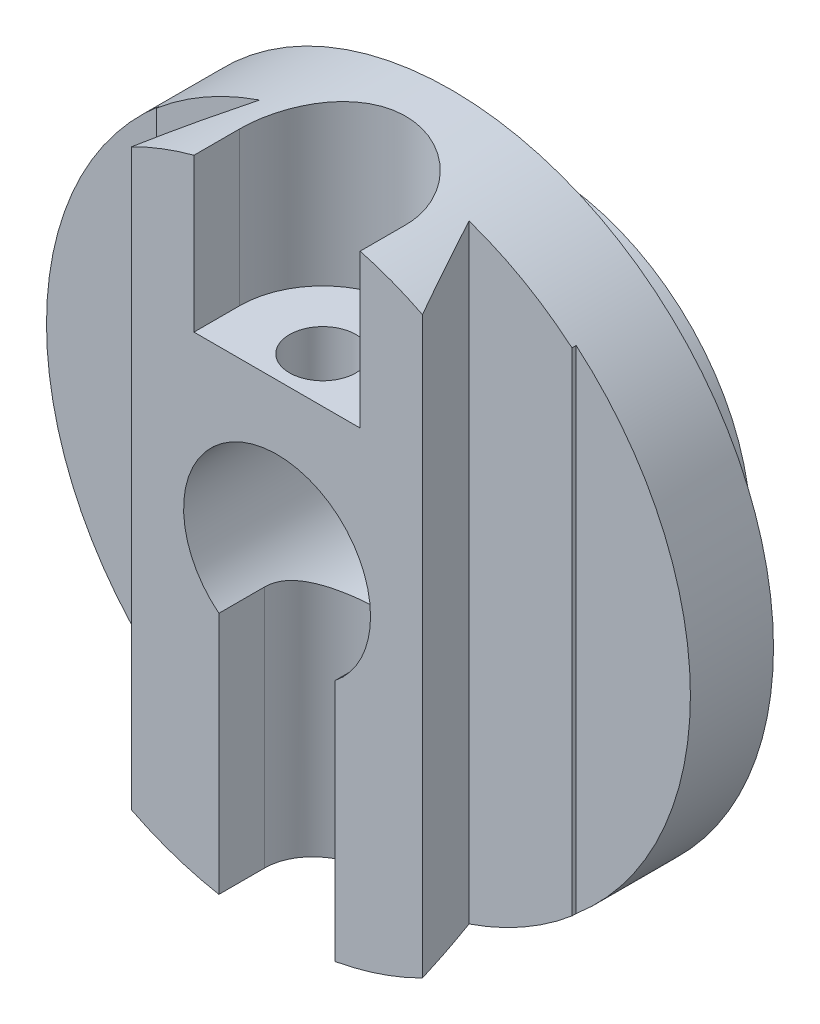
SolidWorks part; units mm, degrees
ref_plane "Front Plane" through (0, 0, 0) normal (0, 0, 1) x (1, 0, 0)
ref_plane "Top Plane" through (0, 0, 0) normal (0, 1, 0) x (1, 0, 0)
ref_plane "Right Plane" through (0, 0, 0) normal (1, 0, 0) x (0, 0, -1)
sketch "Sketch1" plane through (0, 0, 0) normal (0, 0, 1) x (1, 0, 0)
  circle A0 centre (0, 0) radius 77.5
  dimension "D1" = 155
extrude "Boss-Extrude1" add sketch "Sketch1" along normal blind 64
sketch "Sketch2" plane through (0, 0, 0) normal (0, 1, 0) x (1, 0, 0)
  line L0 (77.5, 0) -> (-77.5, 0) construction
  line L1 (50, 0) -> (-50, 0)
  line L2 (50, 0) -> (50, -22)
  line L3 (-77.5, -22) -> (-77.5, 0)
  line L4 (-50, 0) -> (-50, -22)
  line L5 (0, 0) -> (0, -91.0619) construction
  line L6 (-35, -64) -> (-25.2075, -43)
  line L7 (-77.5, -64) -> (77.5, -64) construction
  line L8 (-25.2075, -43) -> (-50, -43)
  line L9 (-50, -43) -> (-50, -42)
  line L10 (-50, -42) -> (-77.5, -42)
  line L11 (-77.5, 0) -> (-77.5, -64) construction
  line L12 (-77.5, -42) -> (-77.5, -22)
  line L13 (-77.5, -22) -> (-50, -22)
  line L14 (-35, -64) -> (35, -64)
  line L15 (77.5, -22) -> (50, -22)
  line L16 (77.5, -42) -> (77.5, -22)
  line L17 (50, -42) -> (77.5, -42)
  line L18 (50, -43) -> (50, -42)
  line L19 (25.2075, -43) -> (50, -43)
  line L20 (35, -64) -> (25.2075, -43)
  line L21 (-77.5, 0) -> (-50, 0)
  line L22 (-77.5, -42) -> (-77.5, -64)
  line L23 (-77.5, -64) -> (-35, -64)
  line L24 (77.5, -64) -> (35, -64)
  line L25 (77.5, -42) -> (77.5, -64)
  line L26 (77.5, 0) -> (50, 0)
  line L27 (77.5, -22) -> (77.5, 0)
  point P22 (0, -64)
  dimension "D1" = 21
  dimension "D2" = 65
  dimension "D3" = 1
  dimension "D4" = 42
  dimension "D5" = 100
  dimension "D6" = 35
  dimension "D7" = 50
extrude "Cut-Extrude1" cut sketch "Sketch2" against normal mid plane 200 contours L21 L3 L13 L4 | L22 L23 L6 L8 L9 L10 | L25 L17 L18 L19 L20 L24 | L15 L27 L26 L2
sketch "Sketch3" plane through (0, 0, 0) normal (0, 1, 0) x (1, 0, 0)
  line L1 (-50, 0) -> (50, 0)
  line L2 (-50, 0) -> (-50, -22)
  line L3 (-50, -22) -> (50, -22)
  line L4 (50, 0) -> (50, -22)
extrude "Cut-Extrude2" cut sketch "Sketch3" against normal mid plane 200
sketch "Sketch4" plane through (0, 0, 22) normal (0, 0, -1) x (-1, 0, 0)
  circle A0 centre (0, 0) radius 50
  dimension "D1" = 100
extrude "Boss-Extrude2" add sketch "Sketch4" along normal blind 22
hole_wizard "Hole1" positions "Sketch5" profile "Sketch6" legacy
sketch "Sketch5" plane through (0, 0, 64) normal (0, 0, 1) x (1, 0, 0)
  point P0 (0, 0)
sketch "Sketch6" plane through (0, 0, 64) normal (1, 0, 0) x (0, -1, 0)
  line L0 (0, 0) -> (0, 64)
  line L1 (0, 64) -> (11, 64)
  line L2 (11, 64) -> (11, 42)
  line L3 (11, 42) -> (22.5, 42)
  line L4 (22.5, 42) -> (22.5, 0)
  line L5 (22.5, 0) -> (0, 0)
  line L6 (0, 110) -> (0, -10) construction
  dimension "Diameter" = 22
  dimension "Depth" = 64
  dimension "C-Bore Diameter" = 45
  dimension "C-Bore Depth" = 42
ref_plane "Plane1" through (0, 77.5, 0) normal (0, 1, 0) x (1, 0, 0)
sketch "Sketch8" plane through (0, 77.5, 0) normal (0, 1, 0) x (1, 0, 0)
  line L0 (-35, -64) -> (35, -64) construction
  line L1 (-20, -64) -> (20, -64)
  line L2 (-20, -64) -> (-20, -53)
  line L4 (20, -64) -> (20, -53)
  arc A0 (-20, -53) -> (20, -53) centre (0, -53) cw
  point P7 (0, 0)
  dimension "D1" = 20
  dimension "D2" = 11
extrude "Cut-Extrude3" cut sketch "Sketch8" against normal blind 39.5
sketch "Sketch9" plane through (0, 0, 0) normal (0, 1, 0) x (1, 0, 0)
  line L0 (-20, -64) -> (20, -64) construction
  line L1 (-14, -64) -> (14, -64)
  line L2 (-14, -64) -> (-14, -53)
  line L4 (14, -64) -> (14, -53)
  arc A0 (-14, -53) -> (14, -53) centre (0, -53) cw
  point P7 (0, 0)
  dimension "D1" = 14
  dimension "D2" = 11
extrude "Cut-Extrude4" cut sketch "Sketch9" along normal blind 77.5 from offset 77.5
sketch "Sketch10" plane through (0, 38, 0) normal (0, 1, 0) x (1, 0, 0)
  circle A0 centre (0, -53) radius 8
  dimension "D1" = 16
extrude "Cut-Extrude6" cut sketch "Sketch10" against normal mid plane 300
